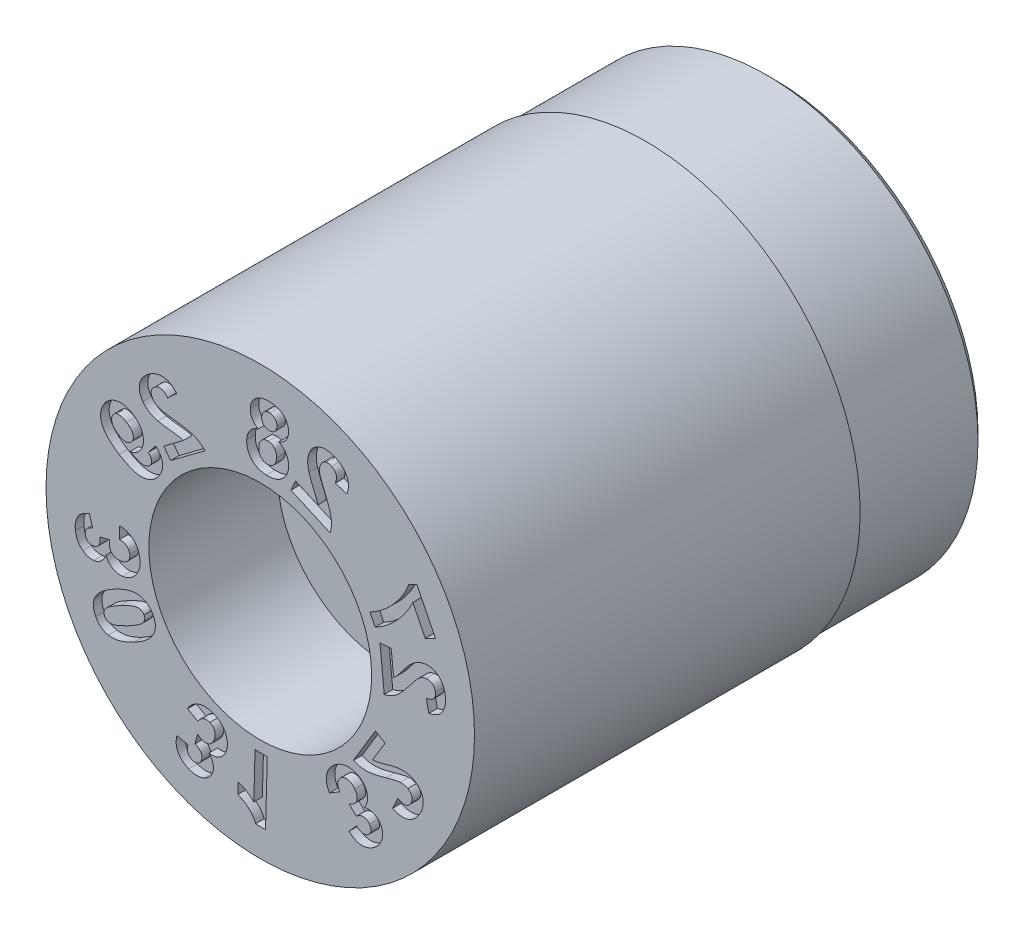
SolidWorks part; units mm, degrees
ref_plane "Front Plane" through (0, 0, 0) normal (0, 0, 1) x (1, 0, 0)
ref_plane "Top Plane" through (0, 0, 0) normal (0, 1, 0) x (1, 0, 0)
ref_plane "Right Plane" through (0, 0, 0) normal (1, 0, 0) x (0, 0, -1)
sketch "Sketch1" plane through (0, 0, 0) normal (1, 0, 0) x (0, 0, -1)
  line L2 (0, 5) -> (0, 2.6)
  line L3 (11.75, 5) -> (0, 5)
  line L4 (-3.7979, 0) -> (49996.2021, 0) construction
  line L8 (12, 1.25) -> (3, 1.25)
  line L9 (3, 2.6) -> (3, 1.25)
  line L10 (3, 2.6) -> (0, 2.6)
  line L12 (12, 1.25) -> (12, 4.75)
  line L16 (12, 4.75) -> (11.75, 5)
  dimension "D1" = 12
  dimension "D2" = 45
  dimension "D3" = 0.25
  dimension "D4" = 10
  dimension "D5" = 5.2
  dimension "D6" = 3
  dimension "D7" = 2.5
revolve "Revolve1" add sketch "Sketch1" angle 360 about L4
sketch "Sketch4" plane through (0, 0, 0) normal (1, 0, 0) x (0, 0, -1)
  line L0 (0, 0) -> (50000, 0) construction
  line L1 (12, -4.75) -> (12, 4.75) construction
  line L2 (9, 5.935) -> (12, 5.935)
  line L3 (9, 5.935) -> (9, 4.935)
  line L4 (9, 4.935) -> (12, 4.935)
  line L5 (12, 5.935) -> (12, 4.935)
  line L6 (11.75, 5) -> (0, 5) construction
  line L9 (0, 5.5) -> (0, -5.5) construction
  dimension "D1" = 1
  dimension "D2" = 0.065
  dimension "D3" = 9
revolve "Cut-Revolve1" cut sketch "Sketch4" angle 360 about L0
sketch "Sketch5" plane through (0, 0, 0) normal (0, 0, 1) x (1, 0, 0)
  circle A0 centre (0, 0) radius 2.9125 construction
  arc A1 (2.8985, -0.2855) -> (2.7656, -0.9133) centre (0, 0) ccw construction
  text T0 "27  28  29  30  31  32" font "Arial" height 1.5
extrude "Cut-Extrude1" cut sketch "Sketch5" against normal blind 0.2
